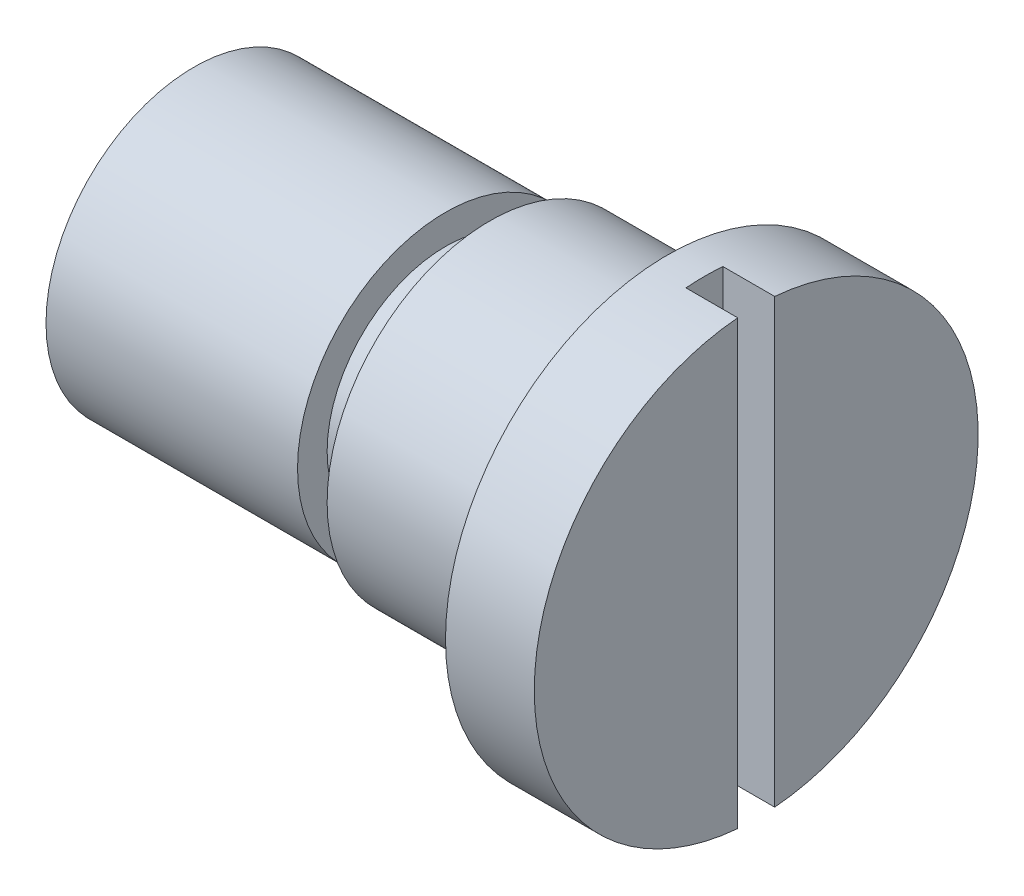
SolidWorks part; units mm, degrees
ref_plane "Front" through (0, 0, 0) normal (0, 0, 1) x (1, 0, 0)
ref_plane "Top" through (0, 0, 0) normal (0, 1, 0) x (1, 0, 0)
ref_plane "Right" through (0, 0, 0) normal (1, 0, 0) x (0, 0, -1)
sketch "Sketch1" plane through (0, 0, 0) normal (0, 0, 1) x (1, 0, 0)
  line L0 (-36.4679, 0) -> (48.8108, 0) construction
  line L1 (0, 0) -> (0, 10)
  line L2 (0, 10) -> (17, 10)
  line L3 (17, 10) -> (17, 8)
  line L4 (17, 8) -> (20, 8)
  line L5 (20, 8) -> (20, 11)
  line L6 (20, 11) -> (32, 11)
  line L7 (32, 11) -> (32, 15)
  line L8 (32, 15) -> (38, 15)
  line L9 (38, 15) -> (38, 0)
  line L10 (38, 0) -> (0, 0)
  dimension "D1" = 20
  dimension "D2" = 30
  dimension "D3" = 6
  dimension "D4" = 38
  dimension "D5" = 12
  dimension "D6" = 16
  dimension "D7" = 3
  dimension "D8" = 22
revolve "Revolve1" add sketch "Sketch1" angle 360 about L0
sketch "Sketch2" plane through (0, 0, 0) normal (0, 1, 0) x (1, 0, 0)
  line L0 (0, 0) -> (43.7972, 0) construction
  line L1 (38, 1.25) -> (34.5, 1.25)
  line L2 (38, -15) -> (38, 15) construction
  line L3 (34.5, 1.25) -> (34.5, -1.25)
  line L4 (38, 1.25) -> (38, -1.25)
  line L5 (38, -1.25) -> (34.5, -1.25)
  point P10 (38, 0)
  point P11 (34.5, 0)
  dimension "D1" = 2.5
  dimension "D2" = 3.5
extrude "Cut-Extrude1" cut sketch "Sketch2" against normal through all and the other way through all
